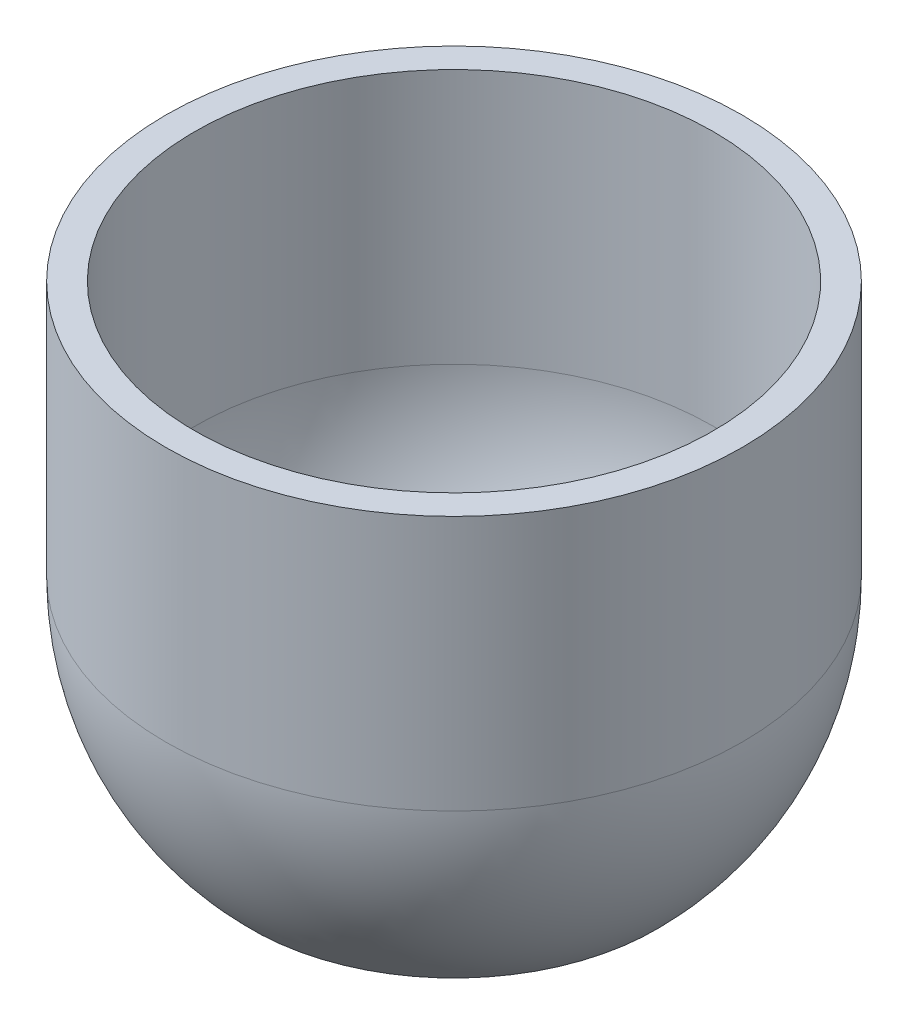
SolidWorks part; units mm, degrees
ref_plane "Front Plane" through (0, 0, 0) normal (0, 0, 1) x (1, 0, 0)
ref_plane "Top Plane" through (0, 0, 0) normal (0, 1, 0) x (1, 0, 0)
ref_plane "Right Plane" through (0, 0, 0) normal (1, 0, 0) x (0, 0, -1)
sketch "Sketch1" plane through (0, 0, 0) normal (0, 0, 1) x (1, 0, 0)
  line L0 (0, 0) -> (0, 80) construction
  line L1 (0, 0) -> (35, 0)
  line L2 (0, 80) -> (50, 80) construction
  line L3 (50, 80) -> (50, 35.7071)
  arc A0 (50, 35.7071) -> (35, 0) centre (0, 35.7071) cw
  dimension "D4" = 50
  dimension "D1" = 70
  dimension "D2" = 80
  dimension "D3" = 100
revolve "Cup" add sketch "Sketch1" angle 360 about L0
